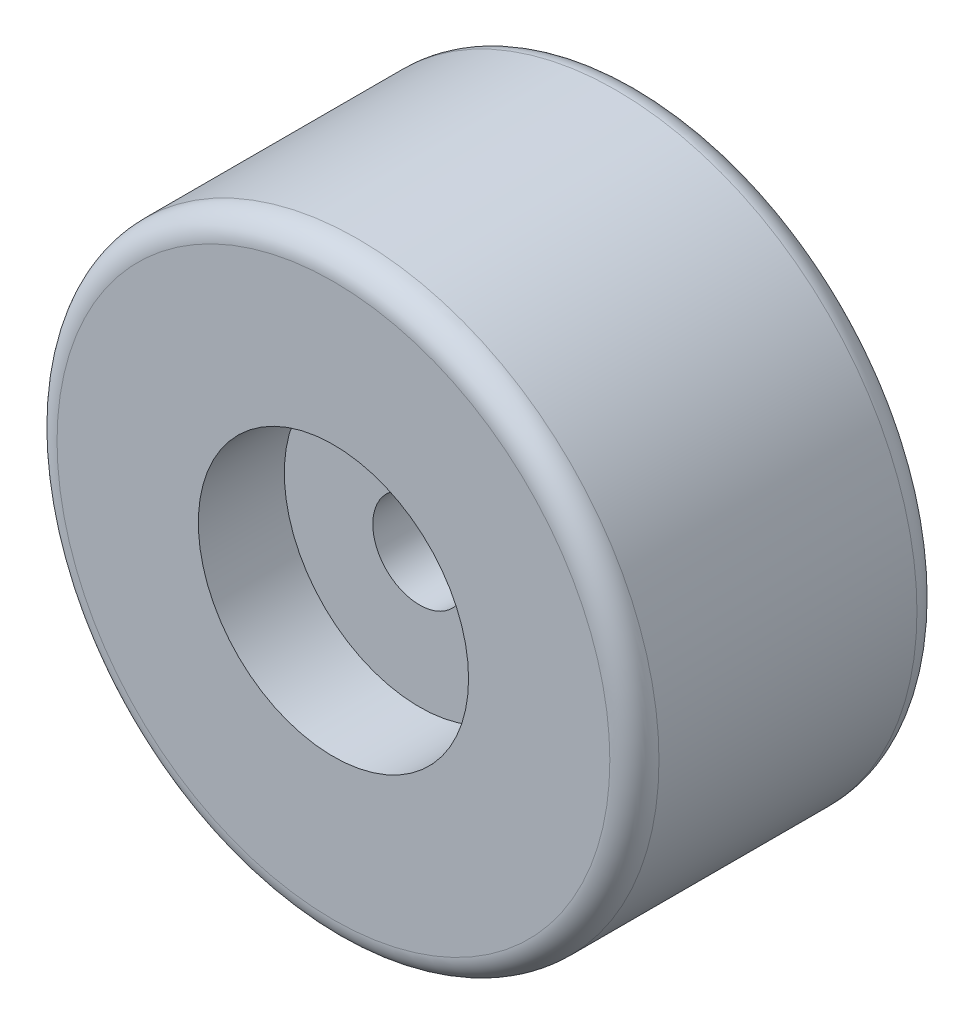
SolidWorks part; units mm, degrees
ref_plane "Front Plane" through (0, 0, 0) normal (0, 0, 1) x (1, 0, 0)
ref_plane "Top Plane" through (0, 0, 0) normal (0, 1, 0) x (1, 0, 0)
ref_plane "Right Plane" through (0, 0, 0) normal (1, 0, 0) x (0, 0, -1)
sketch "Sketch1" plane through (0, 0, 0) normal (0, 0, 1) x (1, 0, 0)
  circle A0 centre (0, 0) radius 31.115
  circle A1 centre (0, 0) radius 4.826
  dimension "D1" = 62.23
  dimension "D2" = 9.652
extrude "Extrude1" add sketch "Sketch1" along normal blind 31.75
fillet "Fillet1" radius 2.54 2 edges at (31.115, 0, 0) (31.115, 0, 31.75)
sketch "Sketch2" plane through (0, 0, 31.75) normal (0, 0, 1) x (1, 0, 0)
  circle A0 centre (0, 0) radius 13.97
  dimension "D1" = 27.94
extrude "Cut-Extrude1" cut sketch "Sketch2" against normal blind 8.89
